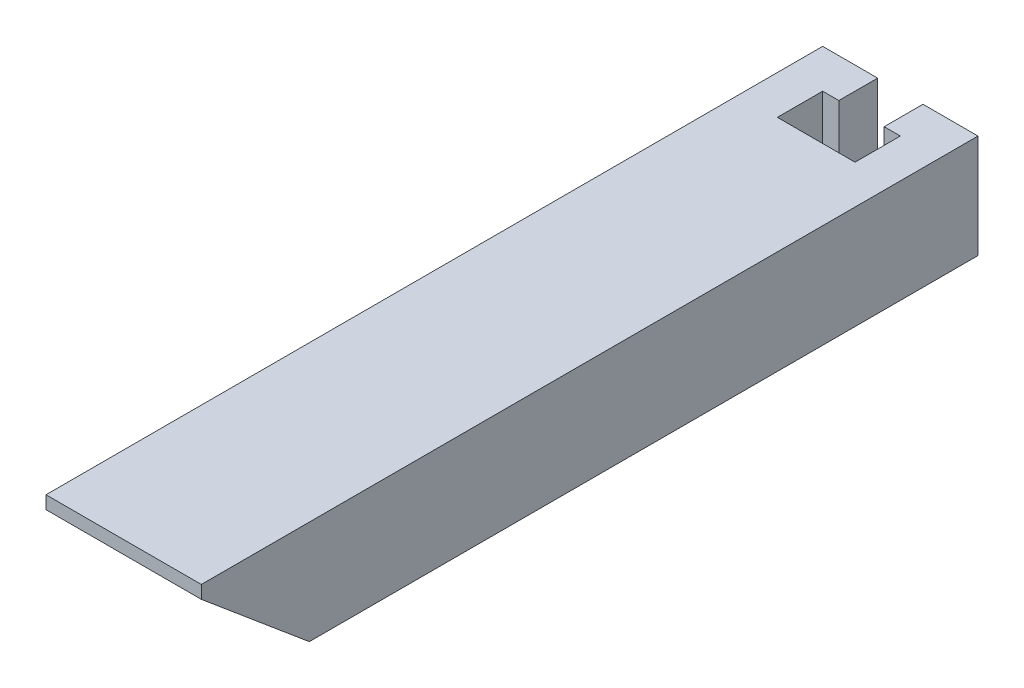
SolidWorks part; units mm, degrees
ref_plane "前视基准面" through (0, 0, 0) normal (0, 0, 1) x (1, 0, 0)
ref_plane "上视基准面" through (0, 0, 0) normal (0, 1, 0) x (1, 0, 0)
ref_plane "右视基准面" through (0, 0, 0) normal (1, 0, 0) x (0, 0, -1)
sketch "草图1" plane through (0, 0, 0) normal (0, 0, 1) x (1, 0, 0)
  line L0 (0, 0) -> (12, 0)
  line L1 (0, 8) -> (12, 8)
  line L2 (0, 0) -> (0, 8)
  line L3 (12, 0) -> (12, 8)
extrude "凸台-拉伸1" add sketch "草图1" along normal blind 60
sketch "草图2" plane through (12, 0, 0) normal (1, 0, 0) x (0, 0, -1)
  line L0 (-51.6577, 0) -> (0, 0)
  line L1 (-60, 7) -> (-60, 8)
  line L2 (0, 0) -> (0, 8)
  line L3 (-60, 8) -> (0, 8)
  line L4 (-60, 7) -> (-51.6577, 0)
extrude "切除-拉伸1" cut sketch "草图2" against normal blind 60 flip side to cut
sketch "草图3" plane through (0, 8, 0) normal (0, 1, 0) x (1, 0, 0)
  line L0 (0, -60) -> (12, -60)
  line L1 (0, -60) -> (0, 0)
  line L2 (12, -60) -> (12, 0)
  line L3 (0, 0) -> (4.25, 0)
  line L4 (3, -3) -> (4.25, -3)
  line L5 (3, -6.5) -> (9, -6.5)
  line L6 (3, -6.5) -> (3, -3)
  line L7 (9, -6.5) -> (9, -3)
  line L8 (4.25, -3) -> (4.25, 0)
  line L9 (7.75, -3) -> (7.75, 0)
  line L10 (7.75, -3) -> (9, -3)
  line L11 (7.75, 0) -> (12, 0)
extrude "切除-拉伸2" cut sketch "草图3" against normal blind 60 flip side to cut
